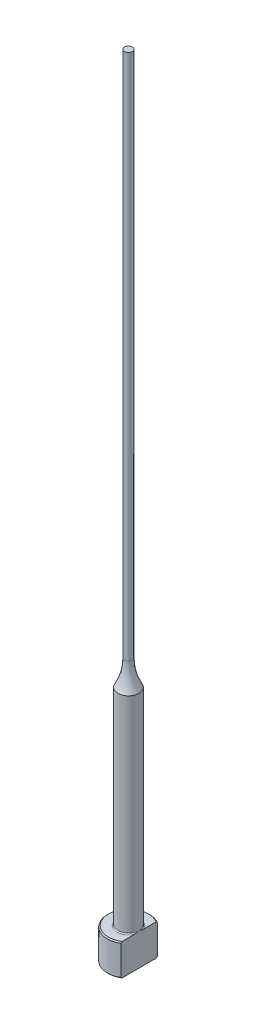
SolidWorks part; units mm, degrees
ref_plane "Front Plane" through (0, 0, 0) normal (0, 0, 1) x (1, 0, 0)
ref_plane "Top Plane" through (0, 0, 0) normal (0, 1, 0) x (1, 0, 0)
ref_plane "Right Plane" through (0, 0, 0) normal (1, 0, 0) x (0, 0, -1)
sketch "Sketch1" plane through (0, 0, 0) normal (0, 0, 1) x (1, 0, 0)
  line L0 (0, 259.9588) -> (0, -15.1925) construction
  line L1 (0, 0) -> (-4, 0)
  line L2 (-4, 0) -> (-4, 6)
  line L3 (-4, 6) -> (-2, 6)
  line L4 (-0.75, 50) -> (-0.75, 150)
  line L5 (-0.75, 150) -> (0, 150)
  line L6 (0, 150) -> (0, 0)
  line L7 (-2, 6) -> (-2, 45.1588)
  arc A0 (-2, 45.1588) -> (-0.75, 50) centre (-10.75, 50) ccw
  point P13 (-2, 0)
  dimension "D1" = 10
  dimension "L" = 150
  dimension "H" = 8
  dimension "T" = 6
  dimension "D" = 1.5
  dimension "B" = 4
  dimension "S" = 50
revolve "Revolve1" add sketch "Sketch1" angle 360 about L0
chamfer "Chamfer1" distance 0.2 angle 45 2 edges at (0, 6, 4) (0, 0, 4)
fillet "Fillet1" radius 0.2 1 edges at (0, 6, 2)
sketch "Sketch2" plane through (0, 0, 0) normal (0, 1, 0) x (1, 0, 0)
  line L0 (2, -3.4641) -> (2, 3.4641)
  circle A0 centre (0, 0) radius 4 construction
  arc A1 (2, -3.4641) -> (2, 3.4641) centre (0, 0) ccw
  circle A2 centre (0, 0) radius 2 construction
extrude "Keyed Head" cut sketch "Sketch2" along normal through all
